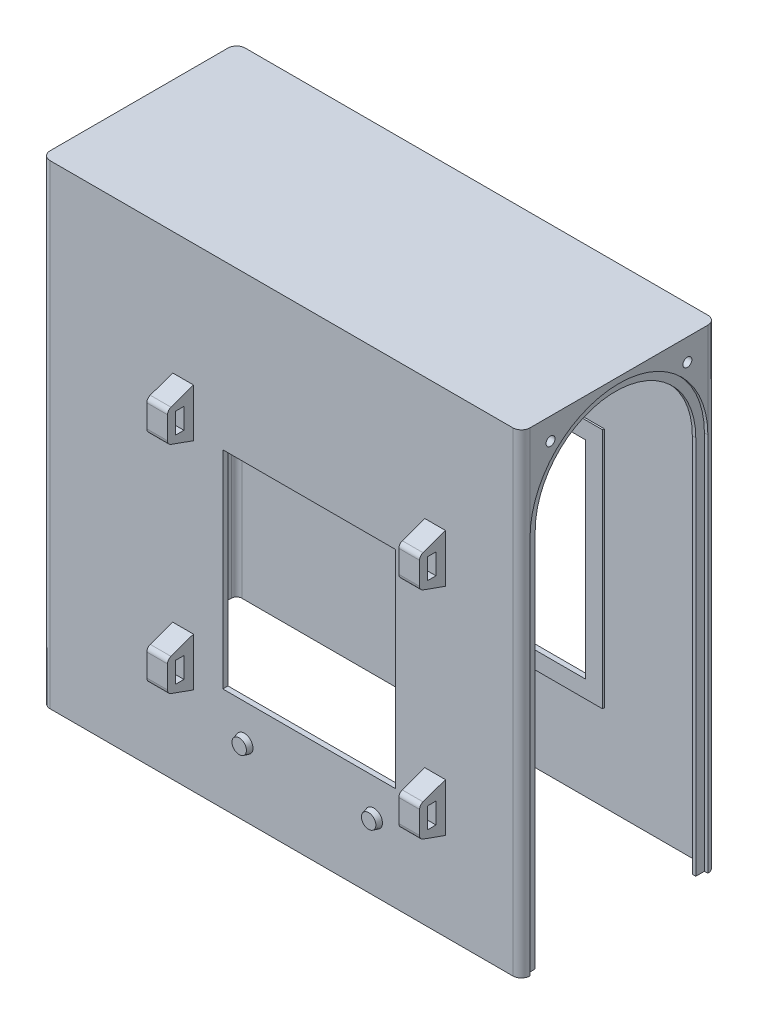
SolidWorks part; units mm, degrees
ref_plane "Front Plane" through (0, 0, 0) normal (0, 0, 1) x (1, 0, 0)
ref_plane "Top Plane" through (0, 0, 0) normal (0, 1, 0) x (1, 0, 0)
ref_plane "Right Plane" through (0, 0, 0) normal (1, 0, 0) x (0, 0, -1)
sketch "Esquisse1" plane through (0, 0, 0) normal (0, 1, 0) x (1, 0, 0)
  line L1 (-134, 56.5) -> (134, 56.5)
  line L2 (-139, 51.5) -> (-139, -51.5)
  line L3 (-134, -56.5) -> (134, -56.5)
  line L4 (139, 51.5) -> (139, -51.5)
  arc A0 (-139, 51.5) -> (-134, 56.5) centre (-134, 51.5) cw
  arc A1 (134, 56.5) -> (139, 51.5) centre (134, 51.5) cw
  arc A2 (-139, -51.5) -> (-134, -56.5) centre (-134, -51.5) ccw
  arc A3 (139, -51.5) -> (134, -56.5) centre (134, -51.5) cw
  point P2 (-139, 0)
  point P4 (0, 0)
  point P5 (0, 56.5)
  dimension "D3" = 5
  dimension "D1" = 278
  dimension "D2" = 113
extrude "Boss.-Extru.1" add sketch "Esquisse1" along normal blind 275
sketch "Esquisse16" plane through (0, 0, 0) normal (0, -1, 0) x (1, 0, 0)
  line L0 (-134, -56.5) -> (134, -56.5) construction
  line L1 (-134, -54.5) -> (131.5, -54.5)
  line L2 (139, -51.5) -> (139, 51.5) construction
  line L3 (135, -51) -> (135, 51)
  line L4 (134, 56.5) -> (-134, 56.5) construction
  line L5 (131.5, 54.5) -> (-134, 54.5)
  line L6 (-139, 51.5) -> (-139, -51.5) construction
  line L7 (-137, 51.5) -> (-137, -51.5)
  line L8 (137, -51.5) -> (137, 51.5) construction
  line L10 (-134, -54.5) -> (134, -54.5) construction
  line L11 (134, 54.5) -> (-134, 54.5) construction
  arc A0 (-139, -51.5) -> (-134, -56.5) centre (-134, -51.5) ccw construction
  arc A1 (-134, 56.5) -> (-139, 51.5) centre (-134, 51.5) ccw construction
  arc A2 (134, -56.5) -> (139, -51.5) centre (134, -51.5) ccw construction
  arc A3 (139, 51.5) -> (134, 56.5) centre (134, 51.5) ccw construction
  arc A4 (135, 51) -> (131.5, 54.5) centre (131.5, 51) ccw
  arc A6 (-134, 54.5) -> (-137, 51.5) centre (-134, 51.5) ccw
  arc A7 (-137, -51.5) -> (-134, -54.5) centre (-134, -51.5) ccw
  arc A8 (131.5, -54.5) -> (135, -51) centre (131.5, -51) ccw
  arc A9 (137, 51.5) -> (134, 54.5) centre (134, 51.5) ccw construction
  arc A10 (134, -54.5) -> (137, -51.5) centre (134, -51.5) ccw construction
  point P32 (136, 51.5)
  dimension "D2" = 4
  dimension "D1" = 2
extrude "Enlèv. mat.-Extru.3" cut sketch "Esquisse16" against normal blind 273.5
sketch "Esquisse4" plane through (139, 0, -85) normal (-1, 0, 0) x (0, 0, 1)
  line L2 (33.5, 220) -> (33.5, 0)
  line L3 (33.5, 0) -> (136.5, 0)
  line L4 (136.5, 220) -> (136.5, 0)
  line L5 (136.5, 0) -> (33.5, 0) construction
  arc A0 (136.5, 220) -> (33.5, 220) centre (85, 220) ccw
  point P5 (85, 0)
  dimension "D4" = 103
  dimension "D1" = 220
extrude "CadreCoté" cut sketch "Esquisse4" along normal blind 2
sketch "Esquisse15" plane through (137, 0, 0) normal (1, 0, 0) x (0, 0, -1)
  line L0 (51.5, 0) -> (-51.5, 0) construction
  line L1 (-46.5, 0) -> (46.5, 0)
  line L2 (-46.5, 0) -> (-46.5, 220)
  line L4 (46.5, 0) -> (46.5, 220)
  line L5 (-51.5, 0) -> (-51.5, 220) construction
  arc A0 (-46.5, 220) -> (46.5, 220) centre (0, 220) cw
  arc A1 (51.5, 220) -> (-51.5, 220) centre (0, 220) ccw construction
  dimension "D1" = 5
extrude "Enlèv. mat.-Extru.1" cut sketch "Esquisse15" against normal up to next contours L2 A0 L4 L1
sketch "Esquisse3" plane through (0, 0, 56.5) normal (0, 0, 1) x (1, 0, 0)
  line L1 (-34, 180) -> (66, 180)
  line L2 (-34, 180) -> (-34, 60)
  line L3 (-34, 60) -> (66, 60)
  line L4 (66, 180) -> (66, 60)
  line L5 (-34, 180) -> (66, 60) construction
  line L6 (-34, 60) -> (66, 180) construction
  line L7 (-134, 0) -> (134, 0) construction
  point P0 (16, 120)
  point P7 (66, 120)
  point P8 (16, 180)
  dimension "D1" = 100
  dimension "D2" = 120
  dimension "D3" = 120
extrude "CadreEclairage" cut sketch "Esquisse3" against normal through all
sketch "Esquisse5" plane through (0, 0, 56.5) normal (0, 0, -1) x (-1, 0, 0)
  line L0 (-76, 190) -> (44, 190)
  line L2 (-66, 180) -> (34, 180)
  line L4 (-66, 180) -> (-66, 60)
  line L6 (-66, 60) -> (34, 60)
  line L7 (34, 180) -> (34, 60)
  line L8 (44, 190) -> (44, 50)
  line L9 (-76, 50) -> (44, 50)
  line L10 (-76, 190) -> (-76, 50)
  dimension "D1" = 10
extrude "BossCadreAV" add sketch "Esquisse5" along normal blind 3
mirror "Symétrie2" about plane through (0, 0, 0) normal (0, 0, 1) of "BossCadreAV"
sketch "Esquisse6" plane through (139, 0, -85) normal (-1, 0, 0) x (0, 0, 1)
  line L13 (124.643, 262.3372) -> (45.357, 262.3372) construction
  line L14 (136.5, 275) -> (33.5, 275) construction
  line L15 (33.5, 275) -> (85, 220) construction
  circle A0 centre (45.357, 262.3372) radius 2.6
  circle A1 centre (124.643, 262.3372) radius 2.6
  arc A5 (136.8683, 245.9553) -> (33.8707, 247.3824) centre (85, 220) ccw construction
  point P2 (85, 262.3372)
  point P5 (85, 275)
  dimension "D1" = 5.2
  dimension "D2" = 58
extrude "TrouVerrou" cut sketch "Esquisse6" along normal up to next
sketch "Esquisse13" plane through (0, 0, 56.5) normal (0, 0, 1) x (1, 0, 0)
  line L0 (-34, 180) -> (-34, 60) construction
  line L1 (-51, 190) -> (83, 190) construction
  line L3 (-51, 65) -> (83, 65) construction
  line L4 (83, 204) -> (95, 204)
  line L5 (83, 204) -> (83, 176)
  line L6 (83, 176) -> (95, 176)
  line L7 (95, 204) -> (95, 176)
  line L8 (83, 79) -> (95, 79)
  line L9 (83, 79) -> (83, 51)
  line L10 (83, 51) -> (95, 51)
  line L11 (95, 79) -> (95, 51)
  line L12 (-63, 79) -> (-51, 79)
  line L13 (-63, 79) -> (-63, 51)
  line L14 (-63, 51) -> (-51, 51)
  line L15 (-51, 79) -> (-51, 51)
  line L16 (-63, 204) -> (-51, 204)
  line L17 (-63, 204) -> (-63, 176)
  line L18 (-63, 176) -> (-51, 176)
  line L19 (-51, 204) -> (-51, 176)
  point P3 (16, 65)
  point P28 (16, 190)
  dimension "D1" = 17
  dimension "D2" = 12
  dimension "D3" = 28
  dimension "D4" = 70
  dimension "D5" = 55
extrude "BossFixProj" add sketch "Esquisse13" along normal blind 15
sketch "Esquisse14" plane through (-63, 0, 0) normal (-1, 0, 0) x (0, 0, 1)
  line L0 (56.5, 204) -> (56.5, 176) construction
  line L1 (67, 71) -> (62, 71)
  line L2 (67, 71) -> (67, 59)
  line L3 (67, 59) -> (62, 59)
  line L4 (62, 71) -> (62, 59)
  line L5 (56.5, 79) -> (56.5, 51) construction
  line L6 (71.5, 79) -> (71.5, 51) construction
  line L7 (67, 196) -> (62, 196)
  line L8 (67, 196) -> (67, 184)
  line L9 (67, 184) -> (62, 184)
  line L10 (62, 196) -> (62, 184)
  line L11 (56.5, 79) -> (71.5, 73.6396)
  line L12 (71.5, 73.6396) -> (71.5, 79)
  line L13 (71.5, 79) -> (56.5, 79)
  line L14 (56.5, 51) -> (71.5, 56.3604)
  line L15 (71.5, 56.3604) -> (71.5, 51)
  line L16 (71.5, 51) -> (56.5, 51)
  line L17 (56.5, 275) -> (56.5, 0) construction
  line L18 (71.5, 51) -> (56.5, 51) construction
  line L19 (56.5, 180) -> (56.5, 60) construction
  line L20 (56.5, 204) -> (71.5, 198.6396)
  line L21 (71.5, 204) -> (71.5, 176) construction
  line L22 (71.5, 198.6396) -> (71.5, 204)
  line L23 (71.5, 204) -> (56.5, 204)
  line L24 (56.5, 176) -> (71.5, 181.3604)
  line L25 (71.5, 181.3604) -> (71.5, 176)
  line L26 (71.5, 176) -> (56.5, 176)
  point P4 (67, 65)
  point P9 (71.5, 65)
  point P14 (62, 190)
  point P17 (56.5, 190)
  dimension "D1" = 12
  dimension "D2" = 5
  dimension "D3" = 5.5
  dimension "D4" = 4
extrude "TrouFixProj" cut sketch "Esquisse14" against normal through all
sketch "Esquisse9" plane through (0, 0, 56.5) normal (0, 0, 1) x (1, 0, 0)
  line L0 (-79.5821, 44) -> (93.7718, 44) construction
  line L3 (-21.5, 39) -> (53.5, 39) construction
  circle A4 centre (-21.5, 39) radius 5
  circle A5 centre (53.5, 39) radius 5
  point P14 (16, 39)
  dimension "D5" = 76
  dimension "D6" = 75
extrude "PionProjecteur" add sketch "Esquisse9" along normal blind 3
fillet "Congé1" radius 3 8 edges at (89, 56.3604, 71.5) (89, 73.6396, 71.5) (-57, 56.3604, 71.5) (-57, 73.6396, 71.5) (89, 181.3604, 71.5) (89, 198.6396, 71.5) (-57, 181.3604, 71.5) (-57, 198.6396, 71.5)
mirror "Symétrie1" about plane through (0, 0, 0) normal (0, 0, 1) of "Congé1", "BossFixProj", "TrouFixProj", "PionProjecteur"
draft "DépouilleAV" type of draft neutral plane draft angle 15 faces to draft 2 parameters "D1"=15
draft "DépouilleAR" type of draft neutral plane draft angle 15 faces to draft 2 parameters "D1"=15
equation "\"EpCoque\"= 1.5"
equation "\"HautCarter\"= 275"
equation "\"D1@Boss.-Extru.1\"=\"HautCarter\""
equation "\"D1@Enlèv. mat.-Extru.3\"=(\"HautCarter\"-\"EpCoque\")"
